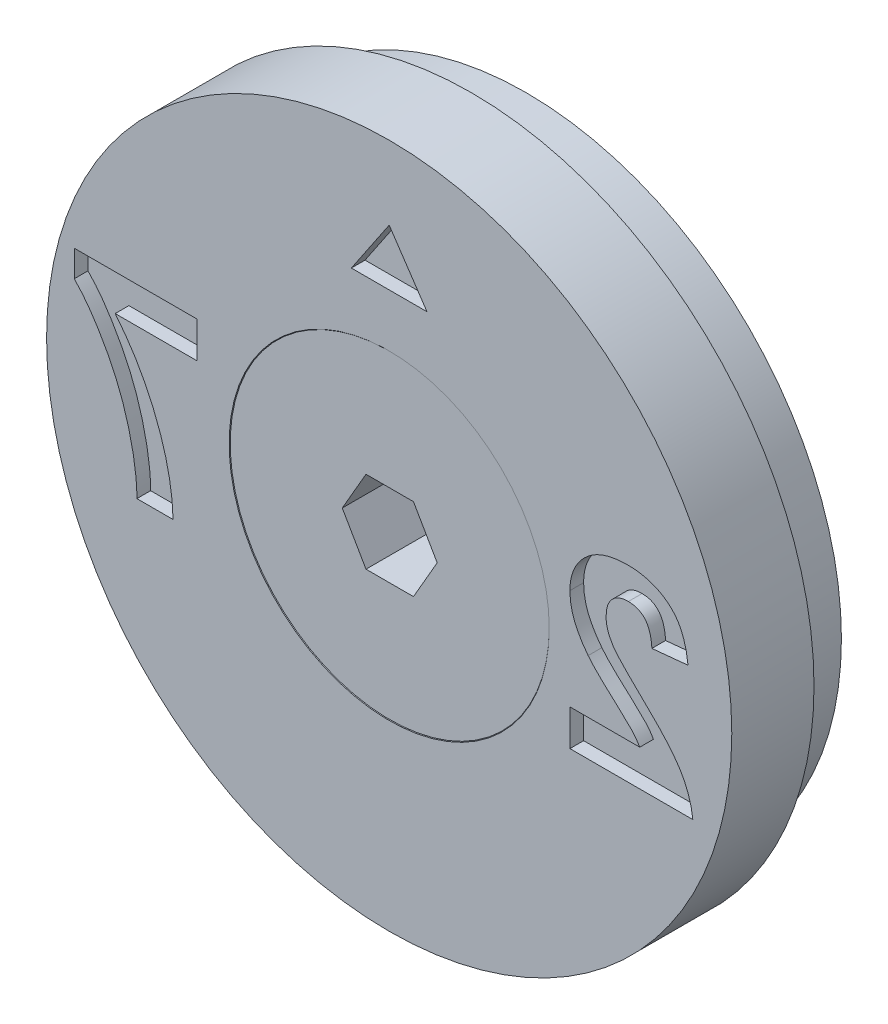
SolidWorks part; units mm, degrees
other "<M5 X .8 FHCS>-<Imported1>"
ref_plane "Front Plane" through (0, 0, 0) normal (0, 0, 1) x (1, 0, 0)
ref_plane "Top Plane" through (0, 0, 0) normal (0, 1, 0) x (1, 0, 0)
ref_plane "Right Plane" through (0, 0, 0) normal (1, 0, 0) x (0, 0, -1)
imported_body "Imported1"
sketch "Sketch1" plane through (0, 0, 0) normal (0, 0, 1) x (1, 0, 0)
  text T0 "2     7" font "Arial" height 6.858
  dimension "D1" = 3.429
  dimension "D2" = 11.43
extrude "Cut-Extrude1" cut sketch "Sketch1" against normal blind 0.5
inserted part "M5 X .8 FHCS"
move or copy body "Body-Move/Copy2" placed by mates yes
